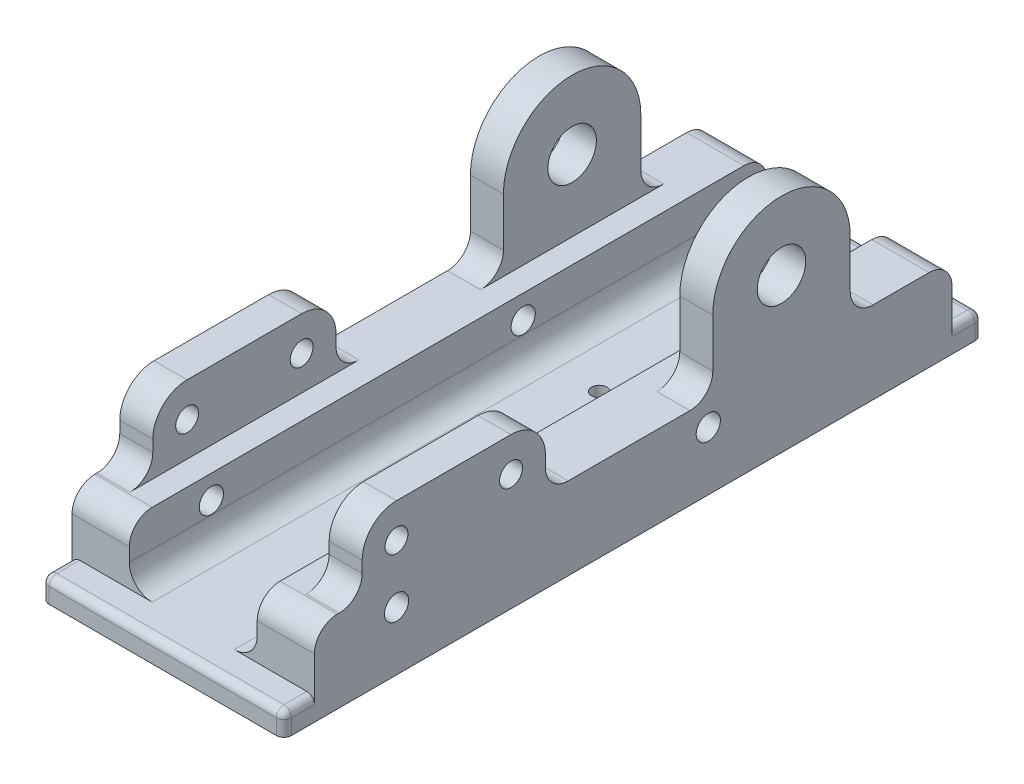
SolidWorks part; units mm, degrees
ref_plane "Front Plane" through (0, 0, 0) normal (0, 0, 1) x (1, 0, 0)
ref_plane "Top Plane" through (0, 0, 0) normal (0, 1, 0) x (1, 0, 0)
ref_plane "Right Plane" through (0, 0, 0) normal (1, 0, 0) x (0, 0, -1)
inserted part "params_print"
inserted part "params_finger_t42"
sketch "Sketch1" plane through (0, 0, 0) normal (1, 0, 0) x (0, 0, -1)
  line L0 (-9, 0) -> (-9, -9.35)
  line L1 (9, 0) -> (9, -9.35)
  line L2 (-61.175, -20.1125) -> (22.325, -20.1125)
  line L3 (-9, -9.35) -> (-30.925, -9.35)
  line L4 (-30.925, -9.35) -> (-30.925, -4.85)
  line L5 (-50.425, -4.85) -> (-35.425, -4.85) construction
  line L6 (-50.425, -0.35) -> (-35.425, -0.35)
  line L7 (-61.175, -20.1125) -> (-61.175, -9.35)
  line L8 (22.325, -20.1125) -> (22.325, -9.35)
  line L9 (-54.925, -4.85) -> (-54.925, -9.35)
  line L10 (9, -9.35) -> (22.325, -9.35)
  line L11 (-61.175, -9.35) -> (-54.925, -9.35)
  circle A0 centre (0, 0) radius 3.175
  circle A1 centre (0, 0) radius 9 construction
  arc A2 (-9, 0) -> (9, 0) centre (0, 0) cw
  circle A3 centre (-50.425, -4.85) radius 1.5
  circle A4 centre (-35.425, -4.85) radius 1.5
  circle A5 centre (-50.425, -4.85) radius 4.5 construction
  circle A6 centre (-35.425, -4.85) radius 4.5 construction
  arc A7 (-30.925, -4.85) -> (-35.425, -0.35) centre (-35.425, -4.85) ccw
  arc A8 (-50.425, -0.35) -> (-54.925, -4.85) centre (-50.425, -4.85) ccw
  circle A9 centre (-50.425, -12.4375) radius 1.5875
  circle A10 centre (-9.5875, -12.4375) radius 1.5875
  point P6 (0, -9)
  point P11 (-19.425, -20.1125)
  point P19 (-50.425, -9.35)
  dimension "D1" = 6.35
  dimension "D2" = 18
  dimension "D7" = 3
  dimension "D8" = 3
  dimension "D10" = 3.175
  dimension "D13" = 9.5875
  dimension "D3" = 83.5
  dimension "D4" = 19.425
  dimension "D5" = 11.5
  dimension "D6" = 15
  dimension "D9" = 0.35
  dimension "D11" = 3.0875
  dimension "D12" = 7.675
extrude "Main Body" add sketch "Sketch1" along normal mid plane 31.75
fillet "Outer Contouring" radius 3 6 edges at (0, -9.35, -22.325) (0, -9.35, -9) (0, -9.35, 9) (0, -9.35, 30.925) (0, -9.35, 54.925) (0, -9.35, 61.175)
sketch "Sketch2" plane through (0, 0, -22.325) normal (0, 0, -1) x (-1, 0, 0)
  line L0 (0, -20.1125) -> (0, 0) construction
  line L1 (-15.875, -20.1125) -> (15.875, -20.1125) construction
  line L2 (-15.875, 9) -> (-15.875, 0) construction
  line L3 (-15.875, 9) -> (-15.875, 0) construction
  line L5 (-8.375, -17.1125) -> (8.375, -17.1125)
  line L6 (-8.375, -17.1125) -> (-8.375, 9)
  line L7 (-8.375, 9) -> (8.375, 9)
  line L8 (8.375, -17.1125) -> (8.375, 9)
  dimension "D1" = 3
  dimension "D2" = 7.5
extrude "Clearance - Middle" cut sketch "Sketch2" against normal through all
sketch "Sketch3" plane through (0, 0, -22.325) normal (0, 0, -1) x (-1, 0, 0)
  line L0 (-15.875, -9.35) -> (-8.375, -9.35) construction
  line L1 (-15.875, -9.35) -> (-8.375, -9.35) construction
  line L2 (0, 0) -> (0, 26.4382) construction
  line L3 (-15.875, 9) -> (-15.875, 0) construction
  line L4 (-15.875, 9) -> (-15.875, 0) construction
  line L6 (-11.55, -9.35) -> (11.55, -9.35)
  line L7 (-11.55, -9.35) -> (-11.55, 9)
  line L8 (-11.55, 9) -> (11.55, 9)
  line L9 (11.55, -9.35) -> (11.55, 9)
  dimension "D1" = 4.325
extrude "Clearance - Finger" cut sketch "Sketch3" against normal through all
sketch "Sketch4" plane through (0, -17.1125, 0) normal (0, 1, 0) x (1, 0, 0)
  line L2 (0, 0) -> (0, -8) construction
  circle A0 centre (0, -8) radius 1
  dimension "D1" = 2
  dimension "D2" = 8
extrude "Clearance - Tendon" cut sketch "Sketch4" against normal through all
sketch "Sketch5" plane through (0, -20.1125, 0) normal (0, -1, 0) x (1, 0, 0)
  line L0 (15.875, -22.325) -> (-15.875, -22.325) construction
  line L1 (-15.875, 61.175) -> (15.875, 61.175)
  line L2 (-15.875, 61.175) -> (-15.875, 65.175)
  line L3 (-15.875, 65.175) -> (15.875, 65.175)
  line L4 (15.875, 61.175) -> (15.875, 65.175)
  line L5 (15.875, -22.325) -> (-15.875, -22.325)
  line L6 (15.875, -22.325) -> (15.875, -26.325)
  line L7 (15.875, -26.325) -> (-15.875, -26.325)
  line L8 (-15.875, -22.325) -> (-15.875, -26.325)
  dimension "D1" = 4
extrude "Base Tabs" add sketch "Sketch5" against normal up to surface (3 mm away)
fillet "Contouring" radius 1 10 edges at (-15.875, -18.6125, -26.325) (15.875, -18.6125, -26.325) (15.875, -17.1125, -24.325) (0, -17.1125, -26.325) (-15.875, -17.1125, -24.325) (15.875, -18.6125, 65.175) (15.875, -17.1125, 63.175) (0, -17.1125, 65.175) (-15.875, -18.6125, 65.175) (-15.875, -17.1125, 63.175)
fillet "Inner Contouring" radius 3 2 edges at (8.375, -17.1125, 19.425) (-8.375, -17.1125, 19.425)
ref_point "Point1"
equation "\"D1@Sketch1\"=\"base pin diameter@values@params_print.SLDPRT\""
equation "\"D2@Sketch1\"=\"height@values@params_finger_t42.SLDPRT\""
equation "\"D3@Sketch1\"=80.5+\"width keep@values@params_print.SLDPRT\""
equation "\"D8@Sketch1\"=\"width keep@values@params_print.SLDPRT\""
equation "\"D9@Sketch1\"=\"print free@values@params_print.SLDPRT\""
equation "\"D10@Sketch1\"=\"pin diameter@values@params_print.SLDPRT\""
equation "\"D11@Sketch1\"=\"pin diameter@values@params_print.SLDPRT\"/2+\"width keep@values@params_print.SLDPRT\"/2"
equation "\"D12@Sketch1\"=\"pin diameter@values@params_print.SLDPRT\"+1.5*\"width keep@values@params_print.SLDPRT\""
equation "\"D1@Main Body\" = \"depth@values@params_finger_t42.SLDPRT\""
equation "\"D1@Sketch2\"=\"width keep@values@params_print.SLDPRT\""
equation "\"D2@Sketch2\"=2.5*\"width keep@values@params_print.SLDPRT\""
equation "\"D1@Sketch3\"=1.5*\"width keep@values@params_print.SLDPRT\"-\"print free@values@params_print.SLDPRT\"/2"
equation "\"D13@Sketch1\"=\"Rp@values@params_finger_t42.SLDPRT\"+\"pin diameter@values@params_print.SLDPRT\"/2"
equation "\"D2@Sketch4\"=\"Rp@values@params_finger_t42.SLDPRT\""
equation "\"D1@Sketch5\"=\"width tab@values@params_print.SLDPRT\""
